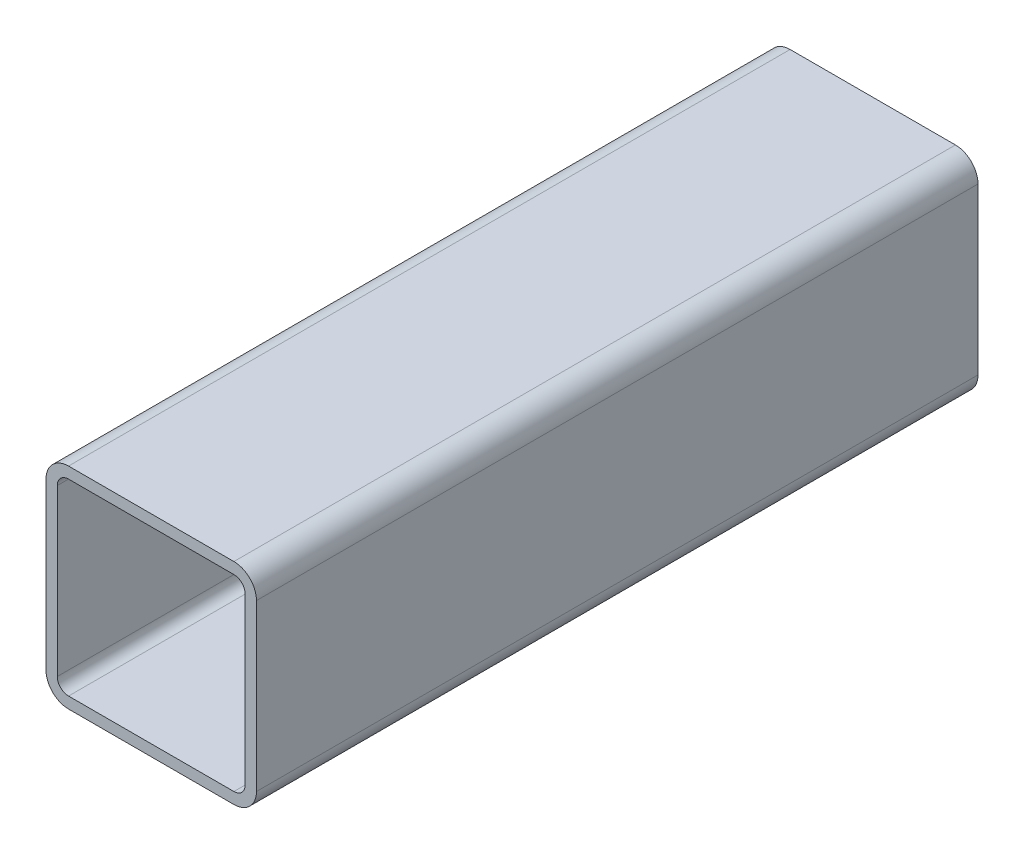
SolidWorks part; units mm, degrees
ref_plane "Front Plane" through (0, 0, 0) normal (0, 0, 1) x (1, 0, 0)
ref_plane "Top Plane" through (0, 0, 0) normal (0, 1, 0) x (1, 0, 0)
ref_plane "Right Plane" through (0, 0, 0) normal (1, 0, 0) x (0, 0, -1)
sketch "Sketch1" plane through (0, 0, 0) normal (0, 0, 1) x (1, 0, 0)
sketch_block_instance "HSS3.5x3.5x0.1875-1"
sketch_block "HSS3.5x3.5x0.1875"
extrude "Boss-Extrude1" add sketch "Sketch1" along normal blind 304.8
